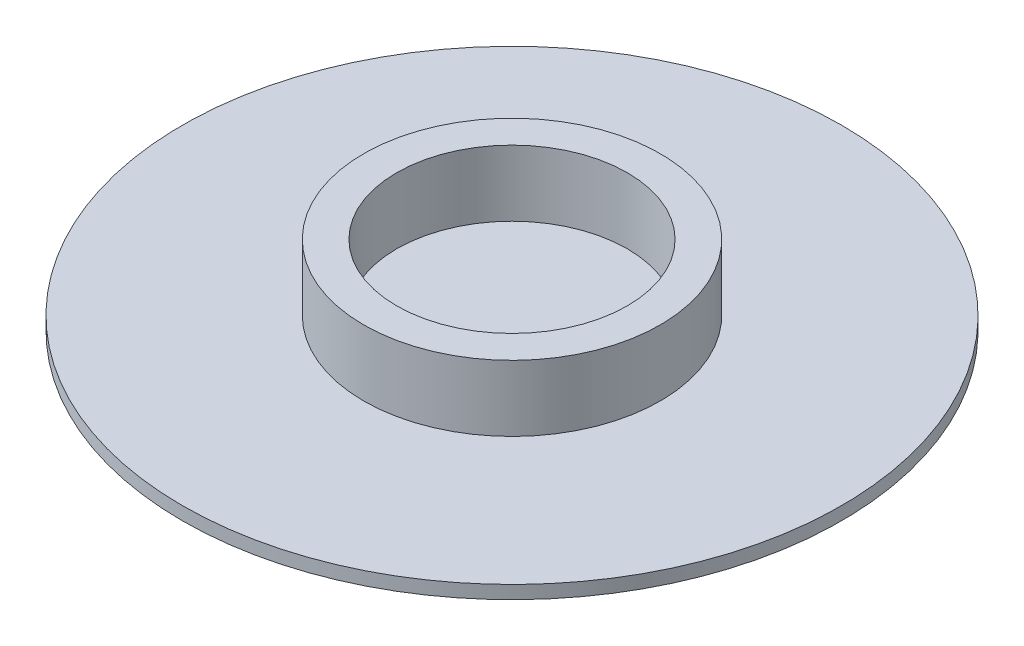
SolidWorks part; units mm, degrees
ref_plane "Front Plane" through (0, 0, 0) normal (0, 0, 1) x (1, 0, 0)
ref_plane "Top Plane" through (0, 0, 0) normal (0, 1, 0) x (1, 0, 0)
ref_plane "Right Plane" through (0, 0, 0) normal (1, 0, 0) x (0, 0, -1)
sketch "Sketch1" plane through (0, 0, 0) normal (0, 1, 0) x (1, 0, 0)
  circle A0 centre (0, 0) radius 63.5
  dimension "D1" = 127
extrude "Boss-Extrude1" add sketch "Sketch1" along normal blind 2.54
sketch "Sketch2" plane through (0, 2.54, 0) normal (0, 1, 0) x (1, 0, 0)
  circle A0 centre (0, 0) radius 28.575
  circle A1 centre (0, 0) radius 22.225
  dimension "D1" = 57.15
  dimension "D2" = 6.35
extrude "Boss-Extrude2" add sketch "Sketch2" along normal blind 12.7
